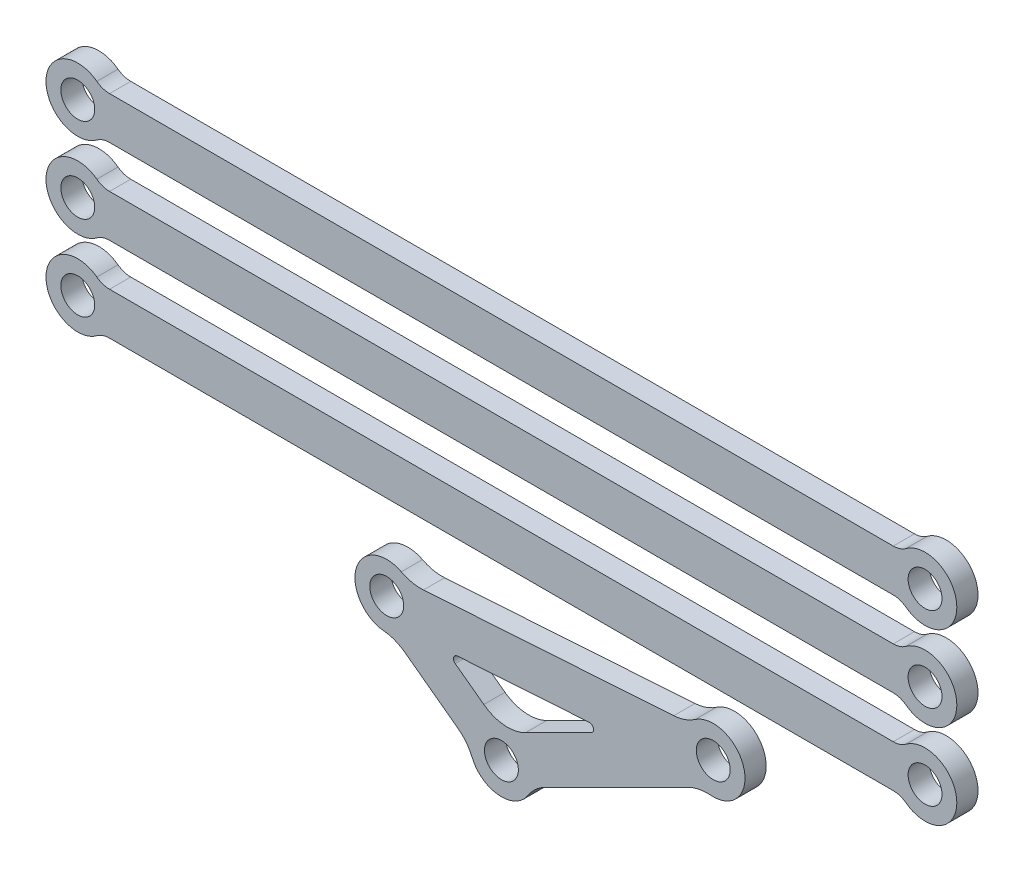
SolidWorks part; units mm, degrees
ref_plane "Alzado" through (0, 0, 0) normal (0, 0, 1) x (1, 0, 0)
ref_plane "Planta" through (0, 0, 0) normal (0, 1, 0) x (1, 0, 0)
ref_plane "Vista lateral" through (0, 0, 0) normal (1, 0, 0) x (0, 0, -1)
sketch "Croquis1" plane through (0, 0, 0) normal (0, 0, 1) x (1, 0, 0)
  line L0 (-100, 0) -> (100, 0) construction
  line L1 (0, 0) -> (0, 50000) construction
  line L2 (-92.5, 5) -> (92.5, 5)
  line L3 (92.5, -5) -> (-92.5, -5)
  circle A0 centre (-100, 0) radius 4
  circle A1 centre (100, 0) radius 4
  arc A2 (-95.5, 6) -> (-95.5, -6) centre (-100, 0) ccw
  arc A3 (-95.5, 6) -> (-92.5, 5) centre (-92.5, 10) ccw
  arc A4 (-95.5, -6) -> (-92.5, -5) centre (-92.5, -10) cw
  arc A5 (95.5, -6) -> (92.5, -5) centre (92.5, -10) ccw
  arc A6 (95.5, 6) -> (95.5, -6) centre (100, 0) cw
  arc A7 (95.5, 6) -> (92.5, 5) centre (92.5, 10) cw
  dimension "D2" = 8
  dimension "D3" = 7.5
  dimension "D4" = 10
  dimension "D5" = 5
  dimension "D1" = 200
extrude "Saliente-Extruir1" add sketch "Croquis1" along normal mid plane 5 contours L2 A7 A6 A5 L3 A4 A2 A3
pattern_linear "MatrizL1" count 2 spacing 20 along (0, -1, 0) count 2 spacing 20 along (0, 1, 0) of "Saliente-Extruir1"
sketch "Croquis2" plane through (0, 0, 0) normal (0, 0, 1) x (1, 0, 0)
  line L0 (0, -65) -> (50, -40) construction
  line L1 (50, -40) -> (50, -65) construction
  line L2 (50, -65) -> (0, -65) construction
  line L3 (0, -65) -> (-27.0711, -65) construction
  line L4 (-27.0711, -65) -> (-27.0711, -45) construction
  line L5 (-27.0711, -45) -> (0, -65) construction
  line L6 (-18.3998, -39.4269) -> (40.6813, -35.594)
  line L7 (44.1738, -48.5033) -> (10.2983, -65.441)
  line L8 (-10.221, -63.6653) -> (-22.7922, -54.3777)
  line L9 (-27.0711, -45) -> (50, -40) construction
  line L10 (-10.9016, -50.7294) -> (-4.1559, -55.7131)
  line L11 (5.6895, -56.5651) -> (21.2123, -48.8037)
  line L12 (-10.3721, -48.9272) -> (20.7004, -46.9113)
  circle A0 centre (0, -65) radius 4
  circle A1 centre (50, -40) radius 4
  circle A2 centre (-27.0711, -45) radius 4
  arc A3 (-6.9271, -67.875) -> (6.3302, -69.0223) centre (0, -65) ccw
  arc A4 (49.4197, -47.4775) -> (45.7288, -33.835) centre (50, -40) ccw
  arc A5 (-23.6323, -38.3348) -> (-27.7839, -52.466) centre (-27.0711, -45) ccw
  arc A6 (-23.6323, -38.3348) -> (-18.3998, -39.4269) centre (-19.0472, -29.4479) ccw
  arc A7 (45.7288, -33.835) -> (40.6813, -35.594) centre (40.0339, -25.615) cw
  arc A8 (49.4197, -47.4775) -> (44.1738, -48.5033) centre (48.6459, -57.4475) ccw
  arc A9 (6.3302, -69.0223) -> (10.2983, -65.441) centre (14.7705, -74.3853) cw
  arc A10 (-6.9271, -67.875) -> (-10.221, -63.6653) centre (-16.1632, -71.7084) ccw
  arc A11 (-27.7839, -52.466) -> (-22.7922, -54.3777) centre (-28.7344, -62.4208) cw
  arc A12 (-4.1559, -55.7131) -> (5.6895, -56.5651) centre (1.4617, -48.1093) ccw
  arc A13 (-10.3721, -48.9272) -> (-10.9016, -50.7294) centre (-10.3074, -49.9251) ccw
  arc A14 (20.7004, -46.9113) -> (21.2123, -48.8037) centre (20.7651, -47.9092) cw
  arc A15 (-19.5868, -44.5145) -> (-23.6323, -38.3348) centre (-27.0711, -45) ccw construction
  arc A16 (-21.0388, -49.4566) -> (-19.5868, -44.5145) centre (-27.0711, -45) ccw construction
  arc A17 (-27.0711, -52.5) -> (-21.0388, -49.4566) centre (-27.0711, -45) ccw construction
  arc A18 (-6.0323, -60.5434) -> (-7.5, -65) centre (0, -65) ccw construction
  arc A19 (0.6466, -57.5279) -> (-6.0323, -60.5434) centre (0, -65) ccw construction
  arc A20 (-7.5, -65) -> (-6.9271, -67.875) centre (0, -65) ccw construction
  arc A21 (7.5, -65) -> (6.7082, -61.6459) centre (0, -65) ccw construction
  arc A22 (6.7082, -61.6459) -> (0.6466, -57.5279) centre (0, -65) ccw construction
  arc A23 (6.3302, -69.0223) -> (7.5, -65) centre (0, -65) ccw construction
  arc A24 (42.5157, -40.4855) -> (43.2918, -43.3541) centre (50, -40) ccw construction
  arc A25 (45.7288, -33.835) -> (42.5157, -40.4855) centre (50, -40) ccw construction
  arc A26 (43.2918, -43.3541) -> (49.4197, -47.4775) centre (50, -40) ccw construction
  arc A27 (-27.7839, -52.466) -> (-27.0711, -52.5) centre (-27.0711, -45) ccw construction
  dimension "D5" = 15
  dimension "D6" = 10
  dimension "D13" = 1
  dimension "D14" = 7.5
  dimension "D16" = 8
  dimension "D1" = 50
  dimension "D2" = 25
  dimension "D3" = 27.0711
  dimension "D4" = 20
  dimension "D7" = 10
  dimension "D8" = 5
  dimension "D9" = 5
  dimension "D10" = 10
  dimension "D11" = 10
  dimension "D12" = 10
  dimension "D15" = 65
extrude "Saliente-Extruir2" add sketch "Croquis2" along normal mid plane 5 separate body
